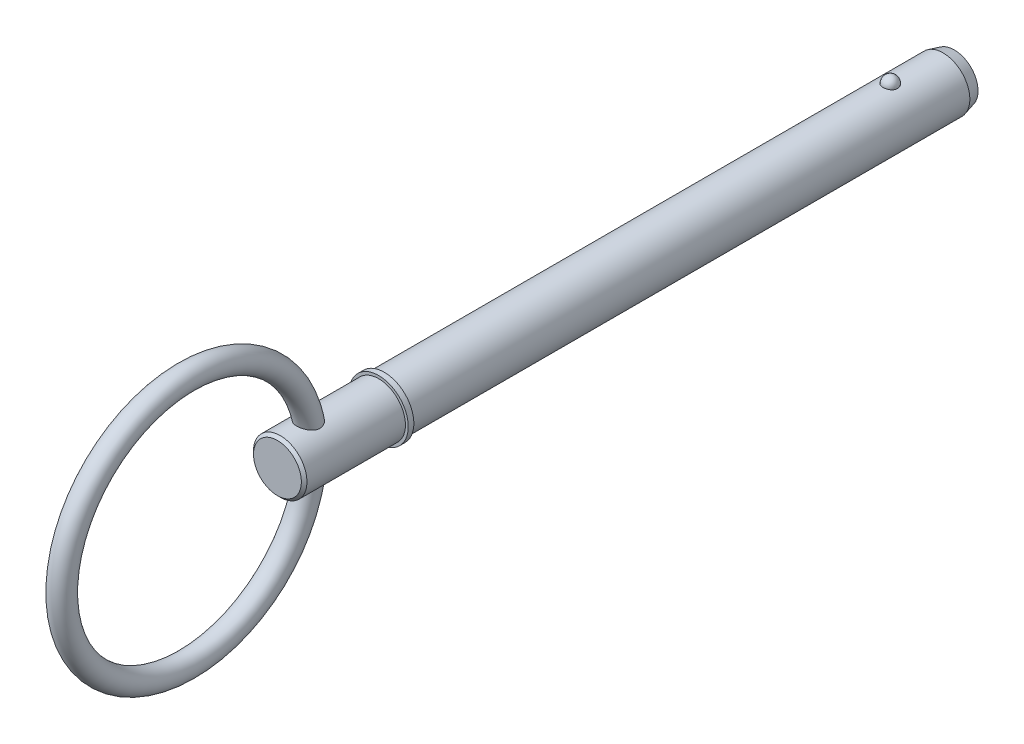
SolidWorks part; units mm, degrees
ref_plane "Front Plane" through (0, 0, 0) normal (0, 0, 1) x (1, 0, 0)
ref_plane "Top Plane" through (0, 0, 0) normal (0, 1, 0) x (1, 0, 0)
ref_plane "Right Plane" through (0, 0, 0) normal (1, 0, 0) x (0, 0, -1)
sketch "Sketch2" plane through (0, 0, 0) normal (0, 0, 1) x (1, 0, 0)
  circle A0 centre (0, 0) radius 4.765
  point P3 (0, 4.765)
  dimension "D1" = 9.53
extrude "Boss-Extrude1" add sketch "Sketch2" along normal blind 88.9
sketch "Sketch3" plane through (0, 0, 0) normal (0, 0, -1) x (-1, 0, 0)
  circle A0 centre (0, 0) radius 4.765
  dimension "D1" = 9.53
extrude "Boss-Extrude2" add sketch "Sketch3" along normal blind 12.7
chamfer "Chamfer1" distance 2 angle 15 1 edges at (-4.765, 0, -12.7)
sketch "Sketch18" plane through (0, 0, 0) normal (1, 0, 0) x (0, 0, -1)
  line L0 (10.7, 4.765) -> (-88.9, 4.765) construction
  line L1 (1.29, 6.055) -> (1.29, 3.475)
  line L2 (-88.9, -4.765) -> (10.7, -4.765) construction
  arc A0 (1.29, 6.055) -> (1.29, 3.475) centre (1.29, 4.765) ccw
  point P4 (0, 4.765)
  dimension "D1" = 10.82
revolve "Revolve1" add sketch "Sketch18" angle 360 about L1
sketch "Sketch19" plane through (0, 0, 0) normal (1, 0, 0) x (0, 0, -1)
  line L0 (-33.7288, 0) -> (-46.4542, 0) construction
sketch "Sketch20" plane through (0, 0, 0) normal (1, 0, 0) x (0, 0, -1)
  line L0 (-88.9, 0) -> (-88.9, 5.265)
  line L1 (-88.9, 4.765) -> (-88.9, -4.765) construction
  line L2 (-88.9, 5.265) -> (-89.9, 5.265)
  line L3 (-89.9, 5.265) -> (-89.9, 0)
  line L4 (-33.7288, 0) -> (-46.4542, 0) construction
  line L5 (-89.9, 0) -> (-88.9, 0)
  dimension "D1" = 5.265
  dimension "D2" = 1
revolve "Revolve2" add sketch "Sketch20" angle 360 about L0
sketch "Sketch21" plane through (0, 0, 88.9) normal (0, 0, -1) x (-1, 0, 0)
  circle A0 centre (0, 0) radius 4.765
  dimension "D1" = 9.53
extrude "Boss-Extrude3" add sketch "Sketch21" against normal blind 19.05
chamfer "Chamfer2" distance 0.5 angle 45 1 edges at (-4.765, 0, 107.95)
sketch "Sketch23" plane through (0, 0, 0) normal (1, 0, 0) x (0, 0, -1)
  line L0 (-107.95, 4.265) -> (-107.95, -4.265) construction
  circle A0 centre (-124.175, 0) radius 22.225
  point P2 (-101.95, 0)
  dimension "D1" = 44.45
  dimension "D2" = 6
sketch "Sketch24" plane through (0, 0, 0) normal (0, 1, 0) x (1, 0, 0)
  circle A0 centre (0, -101.95) radius 2
  dimension "D1" = 4
sweep "Sweep1" add profiles "Sketch24" path "Sketch23"
